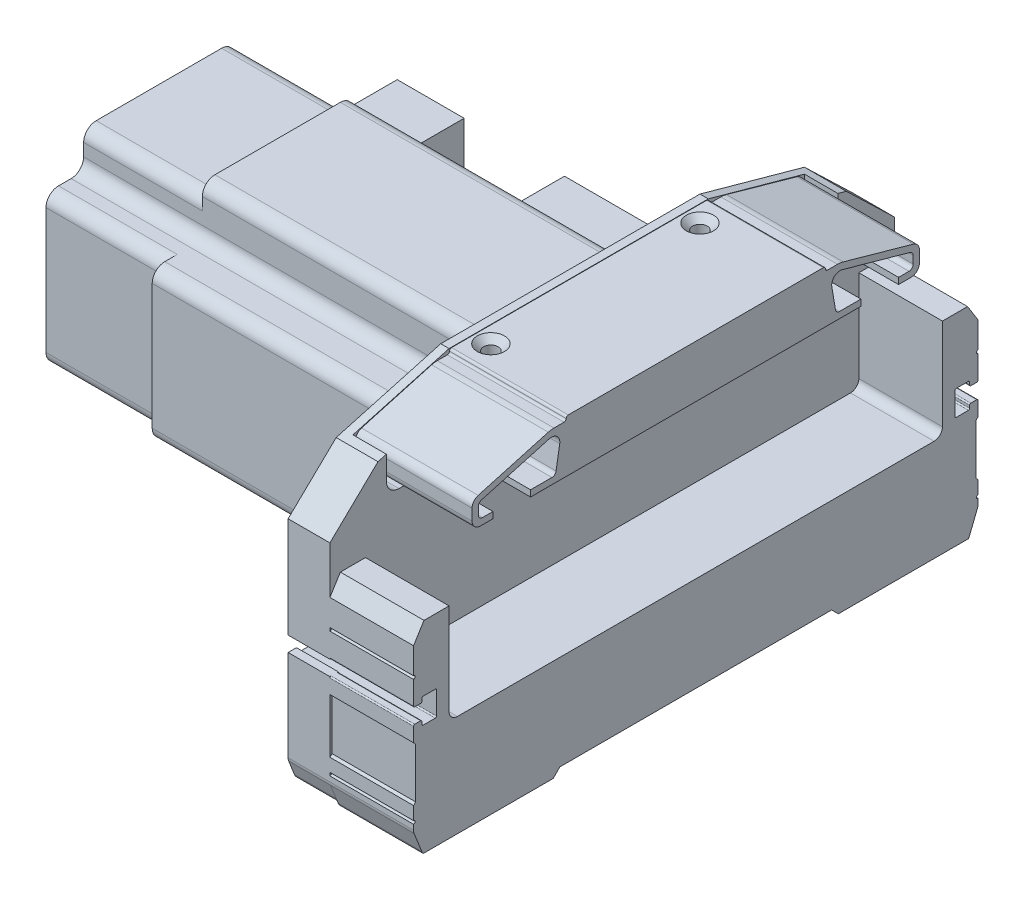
SolidWorks part; units mm, degrees
ref_plane "前视基准面" through (0, 0, 0) normal (0, 0, 1) x (1, 0, 0)
ref_plane "上视基准面" through (0, 0, 0) normal (0, 1, 0) x (1, 0, 0)
ref_plane "右视基准面" through (0, 0, 0) normal (1, 0, 0) x (0, 0, -1)
imported_body "输入2"
imported_body "输入3"
sketch "草图1" plane through (0, 0, 0) normal (0, -1, 0) x (1, 0, 0)
  line L0 (-215, -33.6) -> (-215, -64.1333) construction
  line L1 (269.9509, -140.55) -> (-185, -140.55)
  line L2 (269.9509, -140.55) -> (269.9509, 148.375)
  line L3 (269.9509, 148.375) -> (-185, 148.375)
  line L4 (-185, -140.55) -> (-185, 148.375)
  dimension "D1" = 30
extrude "切除-拉伸1" cut sketch "草图1" against normal up to surface (73.5 mm away)
